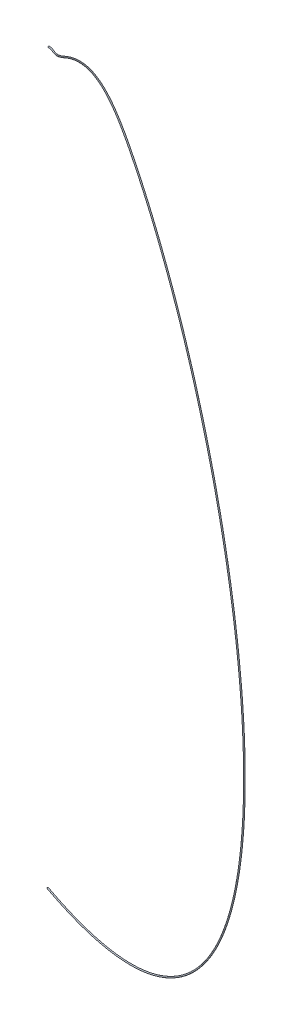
SolidWorks part; units mm, degrees
ref_plane "Front Plane" through (0, 0, 0) normal (0, 0, 1) x (1, 0, 0)
ref_plane "Top Plane" through (0, 0, 0) normal (0, 1, 0) x (1, 0, 0)
ref_plane "Right Plane" through (0, 0, 0) normal (1, 0, 0) x (0, 0, -1)
sketch "Sketch1" plane through (0, 0, 0) normal (1, 0, 0) x (0, 0, -1)
  circle A0 centre (0, 0) radius 3.9624
sketch3d "3DSketch1"
  spline S0 degree 3 poles (0, 0, 0) (3.7111, 0.2597, -0.0578) (19.0416, 1.3324, -0.2967) (62.193, -26.5489, 7.3775) (32.8243, -170.04, -277.6348) (1254.6914, -1722.5694, -125.7517) (1684.7101, -6250.9796, -247.369) (-202.7021, -5175.4315, -195.0726) knots 0 0 0 0 0.002076 0.008577 0.024188 0.142441 1 1 1 1
sweep "Sweep1" add profiles "Sketch1" path "3DSketch1"
ref_plane "Plane1" through (0, 0, 0) normal (0, 0, 1) x (1, 0, 0)
ref_plane "Plane2" through (0, 0, 0) normal (0, 1, 0) x (-1, 0, 0)
